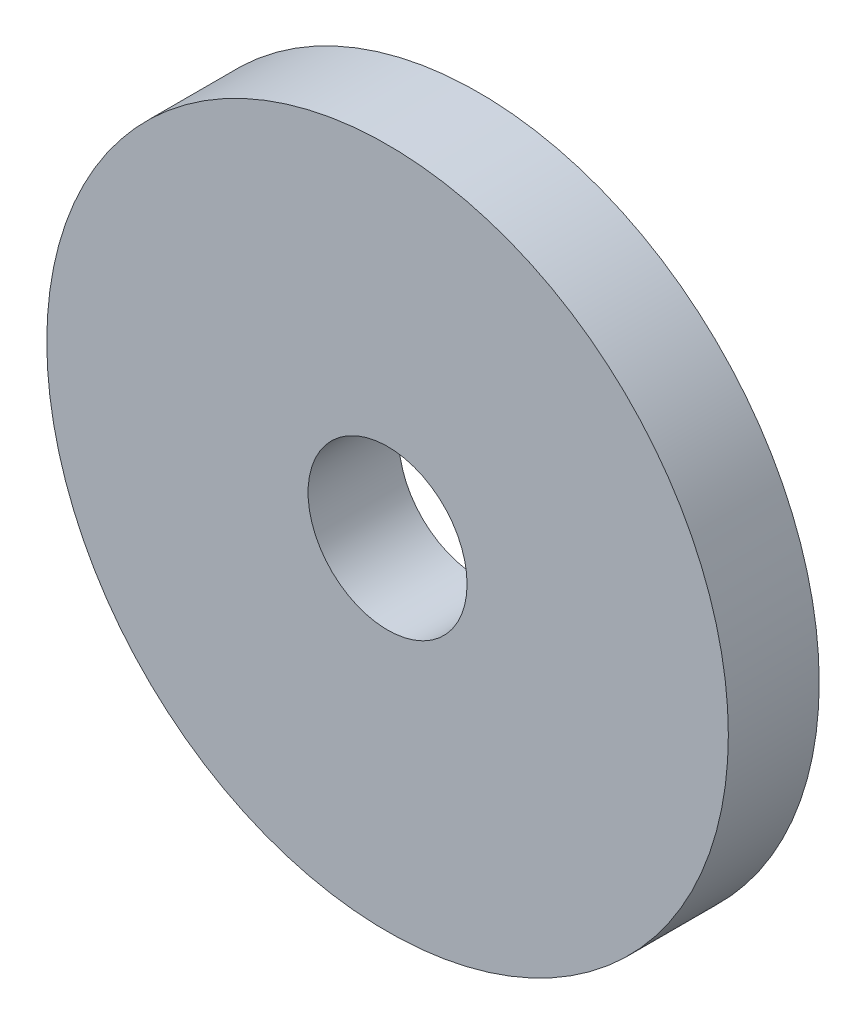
SolidWorks part; units mm, degrees
ref_plane "Plano frontal" through (0, 0, 0) normal (0, 0, 1) x (1, 0, 0)
ref_plane "Plano superior" through (0, 0, 0) normal (0, 1, 0) x (1, 0, 0)
ref_plane "Plano direito" through (0, 0, 0) normal (1, 0, 0) x (0, 0, -1)
sketch "Esboço1" plane through (0, 0, 0) normal (0, 0, 1) x (1, 0, 0)
  circle A0 centre (0, 0) radius 1.75
  circle A1 centre (0, 0) radius 7.5
  dimension "6" = 3.5
  dimension "D2" = 15
extrude "Ressalto-extrusão1" add sketch "Esboço1" along normal blind 2
